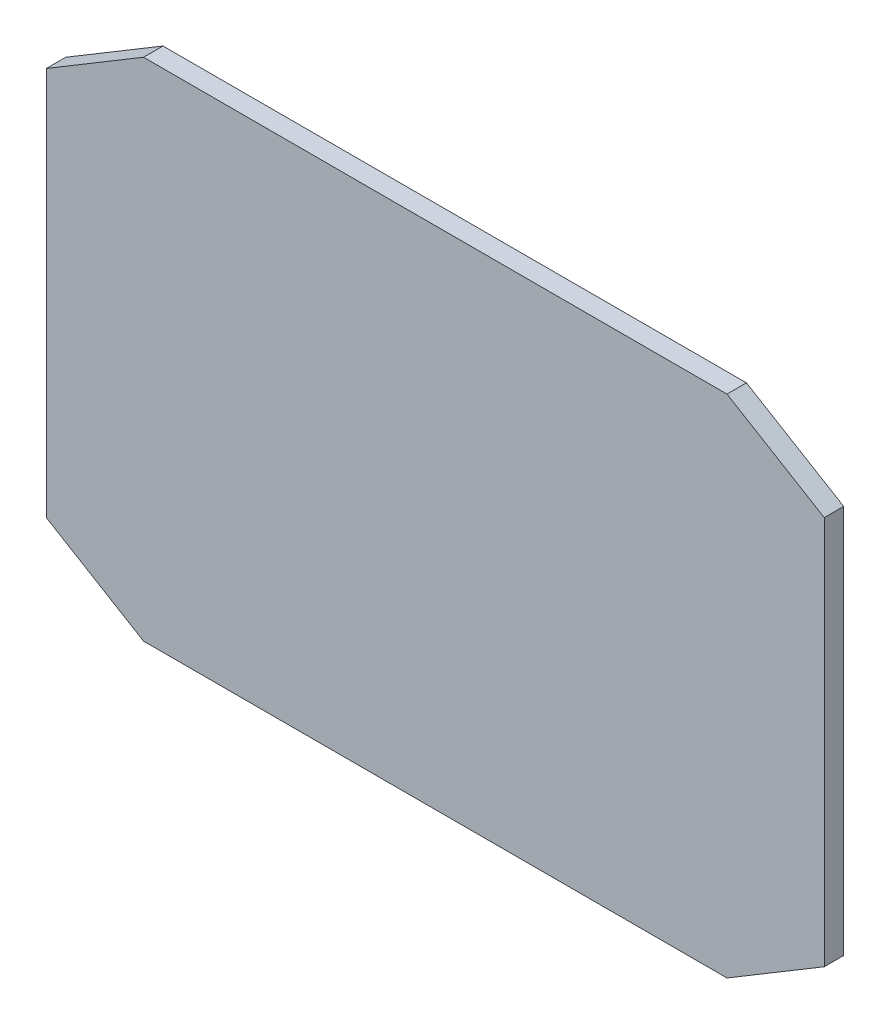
SolidWorks part; units mm, degrees
ref_plane "Plan de face" through (0, 0, 0) normal (0, 0, 1) x (1, 0, 0)
ref_plane "Plan de dessus" through (0, 0, 0) normal (0, 1, 0) x (1, 0, 0)
ref_plane "Plan de droite" through (0, 0, 0) normal (1, 0, 0) x (0, 0, -1)
sketch "Esquisse1" plane through (0, 0, 0) normal (0, 0, 1) x (1, 0, 0)
  line L1 (0, 0) -> (400, 0)
  line L2 (0, 0) -> (0, 260)
  line L3 (0, 260) -> (400, 260)
  line L4 (400, 0) -> (400, 260)
  dimension "D1" = 400
  dimension "D2" = 260
extrude "Extrusion1" add sketch "Esquisse1" along normal blind 10
chamfer "Chanfrein1" distance 50 distance2 30 2 edges at (0, 260, 5) (400, 0, 5)
chamfer "Chanfrein2" distance 30 distance2 50 2 edges at (0, 0, 5) (400, 260, 5)
